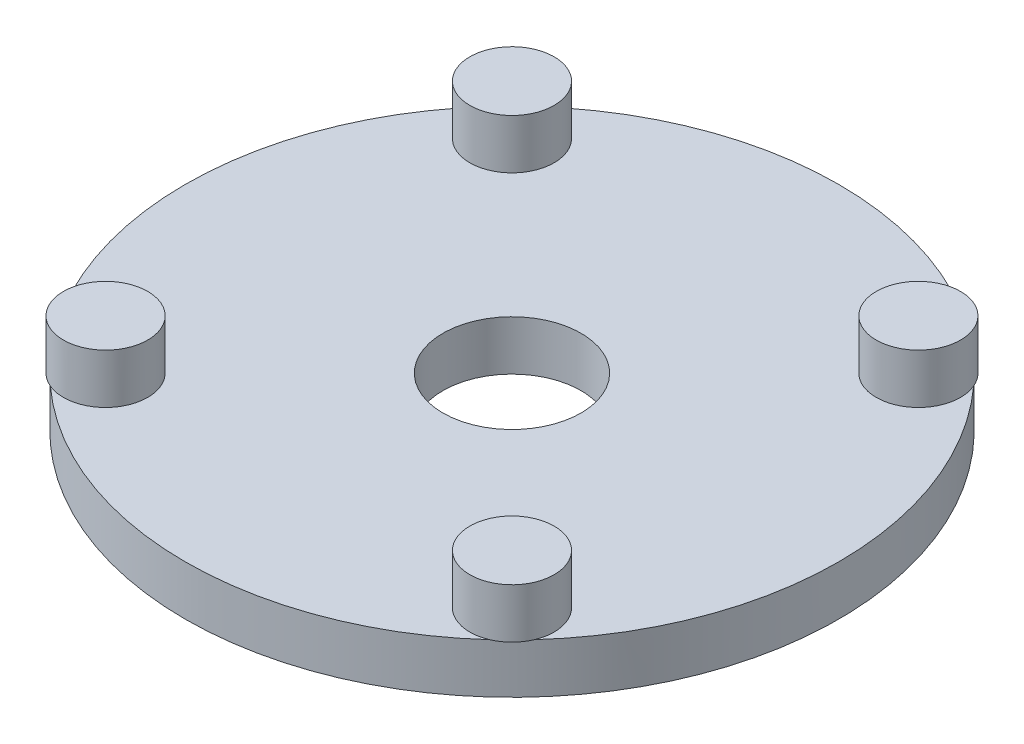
SolidWorks part; units mm, degrees
ref_plane "Front Plane" through (0, 0, 0) normal (0, 0, 1) x (1, 0, 0)
ref_plane "Top Plane" through (0, 0, 0) normal (0, 1, 0) x (1, 0, 0)
ref_plane "Right Plane" through (0, 0, 0) normal (1, 0, 0) x (0, 0, -1)
sketch "Sketch1" plane through (0, 0, 0) normal (0, 1, 0) x (1, 0, 0)
  circle A0 centre (0, 0) radius 29
  dimension "D1" = 58
extrude "Boss-Extrude1" add sketch "Sketch1" along normal blind 4.41 contours A0
sketch "Sketch2" plane through (0, 4.41, 0) normal (0, 1, 0) x (1, 0, 0)
  line L0 (-18.0312, 18.0312) -> (0, 0) construction
  line L1 (0, 0) -> (-29, 0) construction
  line L2 (0, 0) -> (-18.0312, 18.0312) construction
  line L3 (0, 0) -> (18.0312, 18.0312) construction
  circle A0 centre (-18.0312, 18.0312) radius 3.74
  circle A1 centre (0, 0) radius 29 construction
  circle A2 centre (18.0312, 18.0312) radius 3.74
  circle A3 centre (18.0312, -18.0312) radius 3.74
  circle A4 centre (-18.0312, -18.0312) radius 3.74
  point P7 (-0.623, -0.6022)
  point P12 (17.9124, 15.1064)
  dimension "D2" = 7.48
  dimension "D1" = 45
  dimension "D3" = 25.5
  dimension "D5" = 90
  dimension "D4" = 4
extrude "Boss-Extrude2" add sketch "Sketch2" along normal blind 4.41
sketch "Sketch3" plane through (0, 4.41, 0) normal (0, 1, 0) x (1, 0, 0)
  circle A0 centre (0, 0) radius 6.13
  dimension "D1" = 12.26
extrude "Cut-Extrude1" cut sketch "Sketch3" against normal up to next
